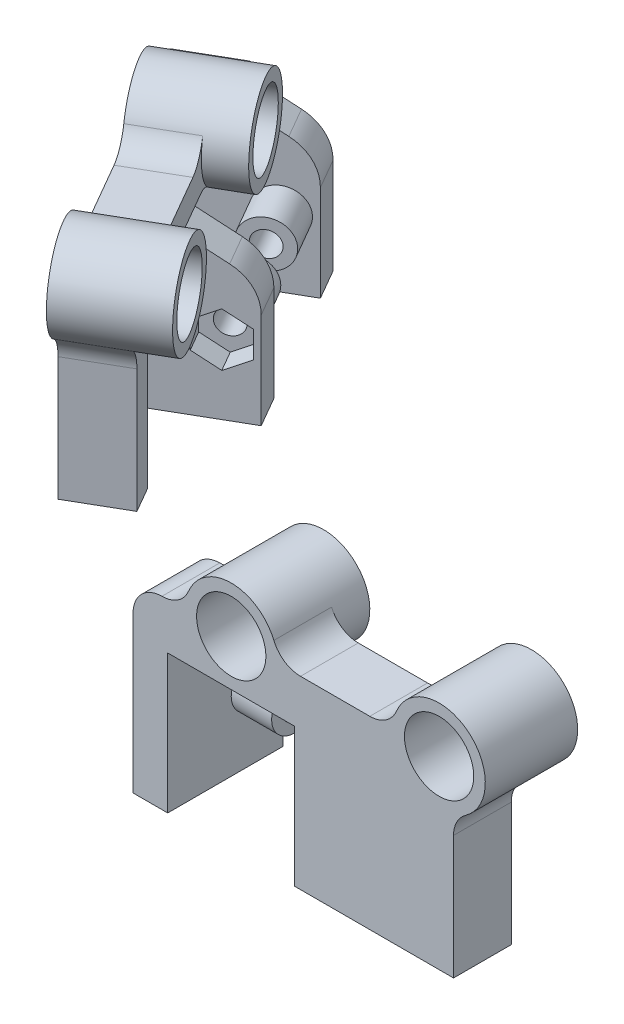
SolidWorks part; units mm, degrees
ref_plane "Plan de face" through (0, 0, 0) normal (0, 0, 1) x (1, 0, 0)
ref_plane "Plan de dessus" through (0, 0, 0) normal (0, 1, 0) x (1, 0, 0)
ref_plane "Plan de droite" through (0, 0, 0) normal (1, 0, 0) x (0, 0, -1)
sketch "Esquisse1" plane through (0, 0, 0) normal (0, 0, 1) x (1, 0, 0)
  line L0 (28, 0) -> (61, 0)
  line L1 (0, 0) -> (6, 0)
  line L2 (0, 0) -> (0, 32)
  line L3 (8, 40) -> (53, 40)
  line L4 (61, 0) -> (61, 32)
  line L6 (6, 0) -> (6, 24)
  line L7 (6, 24) -> (28, 24)
  line L8 (28, 0) -> (28, 24)
  arc A0 (53, 40) -> (61, 32) centre (53, 32) cw
  arc A1 (0, 32) -> (8, 40) centre (8, 32) cw
  dimension "D6" = 8
  dimension "D1" = 61
  dimension "D2" = 40
  dimension "D3" = 6
  dimension "D4" = 24
  dimension "D5" = 22
extrude "Boss.-Extru.1" add sketch "Esquisse1" along normal blind 5
sketch "Esquisse2" plane through (0, 0, 0) normal (0, 0, -1) x (-1, 0, 0)
  line L1 (-28, 0) -> (-61, 0) construction
  line L3 (0, 32) -> (0, 0) construction
  circle A0 centre (-53, 32) radius 8
  circle A1 centre (-17, 32) radius 8
  dimension "D1" = 16
  dimension "D4" = 16
  dimension "D2" = 17
  dimension "D3" = 32
  dimension "D5" = 32
  dimension "D6" = 36
extrude "Boss.-Extru.2" add sketch "Esquisse2" along normal blind 11
sketch "Esquisse3" plane through (0, 0, -11) normal (0, 0, -1) x (-1, 0, 0)
  circle A0 centre (-53, 32) radius 6
  circle A1 centre (-17, 32) radius 6
  dimension "D1" = 12
  dimension "D2" = 12
extrude "Enlèv. mat.-Extru.1" cut sketch "Esquisse3" against normal up to next
sketch "Esquisse4" plane through (0, 0, 0) normal (0, 0, -1) x (-1, 0, 0)
  line L0 (-45, 32) -> (-25, 32)
  line L1 (-46.755, 27) -> (-23.245, 27)
  line L2 (-55.5, 0) -> (-55.5, 24.4007)
  line L3 (-28, 0) -> (-61, 0) construction
  line L4 (-50.5, 0) -> (-50.5, 24.4007)
  line L5 (-10.755, 27) -> (0, 27)
  line L6 (0, 32) -> (0, 0) construction
  line L7 (-9, 32) -> (0, 32)
  line L8 (-50.5, 0) -> (-55.5, 0)
  line L9 (0, 32) -> (0, 27)
  arc A0 (-61, 32) -> (-53, 40) centre (-53, 32) ccw construction
  circle A1 centre (-53, 32) radius 8 construction
  arc A2 (-17, 40) -> (-17, 24) centre (-17, 32) ccw construction
  circle A3 centre (-17, 32) radius 8 construction
  arc A4 (-55.5, 24.4007) -> (-50.5, 24.4007) centre (-53, 32) ccw
  arc A5 (-46.755, 27) -> (-45, 32) centre (-53, 32) ccw
  arc A6 (-10.755, 27) -> (-9, 32) centre (-17, 32) ccw
  arc A7 (-25, 32) -> (-23.245, 27) centre (-17, 32) ccw
  dimension "D1" = 5
  dimension "D2" = 5
  dimension "D3" = 2.5
extrude "Boss.-Extru.3" add sketch "Esquisse4" along normal blind 5
sketch "Esquisse6" plane through (0, 0, 0) normal (0, 0, -1) x (-1, 0, 0)
  line L2 (-45, 32) -> (-25, 32)
  line L3 (-17, 40) -> (-53, 40)
  line L4 (-45, 32) -> (-25, 32)
  line L5 (-17, 40) -> (-53, 40)
  arc A2 (-45, 32) -> (-53, 40) centre (-53, 32) ccw
  arc A3 (-17, 40) -> (-25, 32) centre (-17, 32) ccw
  arc A4 (-45, 32) -> (-53, 40) centre (-53, 32) ccw
  arc A5 (-17, 40) -> (-25, 32) centre (-17, 32) ccw
  dimension "D1" = 0
extrude "Enlèv. mat.-Extru.4" cut sketch "Esquisse6" against normal up to next
sketch "Esquisse7" plane through (0, 0, 0) normal (0, 0, -1) x (-1, 0, 0)
  line L3 (-61, 0) -> (-55.5, 0)
  line L4 (-55.5, 0) -> (-55.5, 24.4007)
  line L5 (-61, 32) -> (-61, 0)
  line L6 (-61, 0) -> (-55.5, 0)
  line L7 (-55.5, 0) -> (-55.5, 24.4007)
  line L8 (-61, 32) -> (-61, 0)
  arc A1 (-61, 32) -> (-55.5, 24.4007) centre (-53, 32) ccw
  arc A2 (-61, 32) -> (-55.5, 24.4007) centre (-53, 32) ccw
  dimension "D1" = 0
extrude "Enlèv. mat.-Extru.5" cut sketch "Esquisse7" against normal up to next
sketch "Esquisse8" plane through (0, 0, 0) normal (0, 0, -1) x (-1, 0, 0)
  line L2 (-9, 32) -> (0, 32)
  line L3 (-8, 40) -> (-17, 40)
  line L4 (-9, 32) -> (0, 32)
  line L5 (-8, 40) -> (-17, 40)
  arc A2 (-9, 32) -> (-17, 40) centre (-17, 32) ccw
  arc A3 (0, 32) -> (-8, 40) centre (-8, 32) ccw
  arc A4 (-9, 32) -> (-17, 40) centre (-17, 32) ccw
  arc A5 (0, 32) -> (-8, 40) centre (-8, 32) ccw
  dimension "D1" = 0
extrude "Enlèv. mat.-Extru.6" cut sketch "Esquisse8" against normal up to next
sketch "Esquisse9" plane through (0, 0, 0) normal (-1, 0, 0) x (0, 0, 1)
  line L0 (0, 0) -> (-15, 0)
  line L1 (-5, 27) -> (-11, 23.5359)
  line L2 (-15, 16.6077) -> (-15, 0)
  line L3 (0, 27) -> (0, 0) construction
  line L5 (0, 0) -> (0, 24.4007) construction
  line L6 (-5, 27) -> (0, 27) construction
  line L8 (0, 0) -> (0, 27)
  line L9 (-5, 27) -> (0, 27)
  arc A0 (-11, 23.5359) -> (-15, 16.6077) centre (-7, 16.6077) ccw
  dimension "D3" = 8
  dimension "D1" = 15
  dimension "D2" = 120
extrude "Boss.-Extru.4" add sketch "Esquisse9" against normal blind 6
pattern_linear "Répétition linéaire1" count 2 spacing 28 along (1, 0, 0) of "Boss.-Extru.4"
sketch "Esquisse10" plane through (6, 0, 0) normal (1, 0, 0) x (0, 0, -1)
  line L0 (-5, 0) -> (15, 0) construction
  line L1 (-5, 0) -> (-5, 24) construction
  circle A0 centre (10, 12) radius 4
  dimension "D1" = 8
  dimension "D2" = 12
  dimension "D3" = 15
extrude "Boss.-Extru.5" add sketch "Esquisse10" along normal blind 7
pattern_linear "Répétition linéaire2" count 2 spacing 15 along (1, 0, 0) of "Boss.-Extru.5"
sketch "Esquisse11" plane through (0, 0, 0) normal (-1, 0, 0) x (0, 0, 1)
  circle A0 centre (-10, 12) radius 4
  dimension "D1" = 8
extrude "Enlèv. mat.-Extru.7" cut sketch "Esquisse11" against normal blind 4
sketch "Esquisse12" plane through (34, 0, 0) normal (1, 0, 0) x (0, 0, -1)
  line L1 (14, 9.6906) -> (14, 14.3094)
  line L2 (14, 14.3094) -> (10, 16.6188)
  line L3 (10, 16.6188) -> (6, 14.3094)
  line L4 (6, 14.3094) -> (6, 9.6906)
  line L5 (6, 9.6906) -> (10, 7.3812)
  line L6 (10, 7.3812) -> (14, 9.6906)
  circle A0 centre (10, 12) radius 4 construction
  dimension "D1" = 8
extrude "Enlèv. mat.-Extru.8" cut sketch "Esquisse12" against normal blind 4
sketch "Esquisse13" plane through (4, 0, 0) normal (-1, 0, 0) x (0, 0, 1)
  circle A0 centre (-10, 12) radius 2.15
  dimension "D1" = 4.3
extrude "Enlèv. mat.-Extru.9" cut sketch "Esquisse13" against normal up to surface (26 mm away)
fillet "Congé1" radius 5 9 edges at (10.755, 27, -2.5) (23.245, 27, -2.5) (50.5, 24.4007, -2.5) (55.5, 24.4007, 0) (0, 32, 0) (25, 32, 0) (45, 32, 0) (9, 32, 0) (46.755, 27, -2.5)
sketch "embase" plane through (0, 0, 0) normal (0, -1, 0) x (-1, 0, 0)
  line L0 (0, -5) -> (50.5534, 32.5579)
  line L1 (-55.5, 5) -> (60.9829, 90.6224)
  line L5 (50.5534, 32.5579) -> (78.3034, 80.6224)
  line L6 (78.3034, 80.6224) -> (60.9829, 90.6224)
  line L7 (0, -5) -> (0, 15) construction
  dimension "D1" = 62.9781
  dimension "D2" = 55.5
  dimension "D3" = 144.5664
  dimension "D4" = 20
  dimension "D5" = 53.39
ref_plane "esquisseAppui" through (-23.817, 0, 13.7508) normal (0.866, 0, -0.5) x (-0.5, 0, -0.866)
sketch "Esquisse15" plane through (-23.817, 0, 13.7508) normal (0.866, 0, -0.5) x (-0.5, 0, -0.866)
  line L0 (102.9727, 0) -> (108.9727, 0)
  line L1 (47.9727, 0) -> (80.9727, 0)
  line L2 (47.9727, 0) -> (47.9727, 32)
  line L3 (55.9727, 40) -> (100.9727, 40)
  line L4 (108.9727, 0) -> (108.9727, 32)
  line L6 (80.9727, 0) -> (80.9727, 24)
  line L7 (80.9727, 24) -> (102.9727, 24)
  line L8 (102.9727, 0) -> (102.9727, 24)
  arc A0 (100.9727, 40) -> (108.9727, 32) centre (100.9727, 32) cw
  arc A1 (47.9727, 32) -> (55.9727, 40) centre (55.9727, 32) cw
  point P13 (0, 0)
  dimension "D6" = 8
  dimension "D1" = 61
  dimension "D2" = 40
  dimension "D3" = 6
  dimension "D4" = 22
  dimension "D5" = 24
extrude "Boss.-Extru.6" add sketch "Esquisse15" along normal blind 5 separate body
sketch "Esquisse16" plane through (-19.4869, 0, 11.2508) normal (0.866, 0, -0.5) x (-0.5, 0, -0.866)
  line L0 (108.9727, 0) -> (108.9727, 32) construction
  line L1 (102.9727, 0) -> (108.9727, 0) construction
  line L2 (-23.4199, 0) -> (108.9727, 0) construction
  circle A0 centre (91.9727, 32) radius 8
  circle A1 centre (55.9727, 32) radius 8
  dimension "D3" = 16
  dimension "D4" = 16
  dimension "D1" = 36
  dimension "D2" = 17
  dimension "D5" = 32
  dimension "D6" = 32
extrude "Boss.-Extru.7" add sketch "Esquisse16" along normal blind 11
sketch "Esquisse17" plane through (-9.9606, 0, 5.7508) normal (0.866, 0, -0.5) x (-0.5, 0, -0.866)
  circle A0 centre (91.9727, 32) radius 6
  circle A1 centre (55.9727, 32) radius 6
  dimension "D1" = 12
  dimension "D2" = 12
extrude "Enlèv. mat.-Extru.10" cut sketch "Esquisse17" against normal up to next
sketch "Esquisse20" plane through (-19.4869, 0, 11.2508) normal (0.866, 0, -0.5) x (-0.5, 0, -0.866)
  line L1 (99.9727, 32) -> (108.9727, 32)
  line L8 (108.9727, 0) -> (108.9727, 32) construction
  line L10 (53.4727, 24.4007) -> (53.4727, 0)
  line L11 (-23.4199, 0) -> (108.9727, 0) construction
  line L12 (58.4727, 24.4007) -> (58.4727, 0)
  line L13 (53.4727, 0) -> (58.4727, 0)
  line L14 (63.9727, 32) -> (83.9727, 32)
  line L16 (62.2177, 27) -> (85.7277, 27)
  line L20 (98.2177, 27) -> (108.9727, 27)
  line L21 (108.9727, 32) -> (108.9727, 27)
  arc A0 (91.9727, 24) -> (91.9727, 40) centre (91.9727, 32) ccw construction
  arc A2 (98.2177, 27) -> (99.9727, 32) centre (91.9727, 32) ccw
  circle A9 centre (55.9727, 32) radius 8 construction
  arc A11 (47.9727, 32) -> (55.9727, 40) centre (55.9727, 32) ccw construction
  arc A12 (91.9727, 40) -> (91.9727, 24) centre (91.9727, 32) ccw construction
  circle A13 centre (91.9727, 32) radius 8 construction
  arc A14 (53.4727, 24.4007) -> (58.4727, 24.4007) centre (55.9727, 32) ccw
  arc A15 (62.2177, 27) -> (63.9727, 32) centre (55.9727, 32) ccw
  arc A18 (83.9727, 32) -> (85.7277, 27) centre (91.9727, 32) ccw
  dimension "D1" = 2.5
  dimension "D2" = 5
  dimension "D3" = 5
extrude "Boss.-Extru.10" add sketch "Esquisse20" along normal blind 5
sketch "Esquisse21" plane through (-19.4869, 0, 11.2508) normal (0.866, 0, -0.5) x (-0.5, 0, -0.866)
  line L2 (63.9727, 32) -> (83.9727, 32)
  line L3 (91.9727, 40) -> (55.9727, 40)
  line L4 (63.9727, 32) -> (83.9727, 32)
  line L5 (91.9727, 40) -> (55.9727, 40)
  arc A2 (91.9727, 40) -> (83.9727, 32) centre (91.9727, 32) ccw
  arc A3 (63.9727, 32) -> (55.9727, 40) centre (55.9727, 32) ccw
  arc A4 (91.9727, 40) -> (83.9727, 32) centre (91.9727, 32) ccw
  arc A5 (63.9727, 32) -> (55.9727, 40) centre (55.9727, 32) ccw
  dimension "D1" = 0
extrude "Enlèv. mat.-Extru.11" cut sketch "Esquisse21" against normal up to next
sketch "Esquisse22" plane through (-19.4869, 0, 11.2508) normal (0.866, 0, -0.5) x (-0.5, 0, -0.866)
  line L3 (53.4727, 0) -> (53.4727, 24.4007)
  line L4 (47.9727, 32) -> (47.9727, 0)
  line L5 (47.9727, 0) -> (53.4727, 0)
  line L6 (53.4727, 0) -> (53.4727, 24.4007)
  line L7 (47.9727, 32) -> (47.9727, 0)
  line L8 (47.9727, 0) -> (53.4727, 0)
  arc A1 (47.9727, 32) -> (53.4727, 24.4007) centre (55.9727, 32) ccw
  arc A2 (47.9727, 32) -> (53.4727, 24.4007) centre (55.9727, 32) ccw
  dimension "D1" = 0
extrude "Enlèv. mat.-Extru.12" cut sketch "Esquisse22" against normal up to next
sketch "Esquisse23" plane through (-19.4869, 0, 11.2508) normal (0.866, 0, -0.5) x (-0.5, 0, -0.866)
  line L2 (99.9727, 32) -> (108.9727, 32)
  line L3 (100.9727, 40) -> (91.9727, 40)
  line L4 (99.9727, 32) -> (108.9727, 32)
  line L5 (100.9727, 40) -> (91.9727, 40)
  arc A2 (108.9727, 32) -> (100.9727, 40) centre (100.9727, 32) ccw
  arc A3 (99.9727, 32) -> (91.9727, 40) centre (91.9727, 32) ccw
  arc A4 (108.9727, 32) -> (100.9727, 40) centre (100.9727, 32) ccw
  arc A5 (99.9727, 32) -> (91.9727, 40) centre (91.9727, 32) ccw
  dimension "D1" = 0
extrude "Enlèv. mat.-Extru.13" cut sketch "Esquisse23" against normal up to next
sketch "Esquisse24" plane through (-54.4863, 0, -94.3731) normal (-0.5, 0, -0.866) x (-0.866, 0, 0.5)
  line L0 (22.5015, 0) -> (7.5015, 0)
  line L1 (27.5015, 0) -> (7.5015, 0) construction
  line L2 (7.5015, 0) -> (7.5015, 16.6077)
  line L3 (11.5015, 23.5359) -> (17.5015, 27)
  line L4 (17.5015, 27) -> (22.5015, 27)
  line L5 (22.5015, 27) -> (22.5015, 0)
  arc A0 (7.5015, 16.6077) -> (11.5015, 23.5359) centre (15.5015, 16.6077) cw
  dimension "D2" = 8
  dimension "D1" = 120
  dimension "D3" = 15
extrude "Boss.-Extru.11" add sketch "Esquisse24" against normal blind 6
pattern_linear "Répétition linéaire3" count 2 spacing 28 along (0.5, 0, 0.866) of "Boss.-Extru.11"
sketch "Esquisse25" plane through (-51.4863, 0, -89.177) normal (0.5, 0, 0.866) x (0.866, 0, -0.5)
  line L0 (-7.5015, 0) -> (-27.5015, 0) construction
  line L2 (-27.5015, 24) -> (-27.5015, 0) construction
  circle A0 centre (-12.5015, 12) radius 4
  point P6 (-27.5015, 11.3577)
  dimension "D1" = 8
  dimension "D2" = 12
  dimension "D3" = 15
extrude "Boss.-Extru.12" add sketch "Esquisse25" along normal blind 7
pattern_linear "Répétition linéaire4" count 2 spacing 15 along (0.5, 0, 0.866) of "Boss.-Extru.12"
sketch "Esquisse26" plane through (-54.4863, 0, -94.3731) normal (-0.5, 0, -0.866) x (-0.866, 0, 0.5)
  circle A0 centre (12.5015, 12) radius 4
  dimension "D1" = 8
extrude "Enlèv. mat.-Extru.14" cut sketch "Esquisse26" against normal blind 4
sketch "Esquisse27" plane through (-37.4863, 0, -64.9283) normal (0.5, 0, 0.866) x (0.866, 0, -0.5)
  line L1 (-8.5015, 9.6906) -> (-8.5015, 14.3094)
  line L2 (-8.5015, 14.3094) -> (-12.5015, 16.6188)
  line L3 (-12.5015, 16.6188) -> (-16.5015, 14.3094)
  line L4 (-16.5015, 14.3094) -> (-16.5015, 9.6906)
  line L5 (-16.5015, 9.6906) -> (-12.5015, 7.3812)
  line L6 (-12.5015, 7.3812) -> (-8.5015, 9.6906)
  circle A0 centre (-12.5015, 12) radius 4 construction
  dimension "D1" = 8
extrude "Enlèv. mat.-Extru.15" cut sketch "Esquisse27" against normal blind 4
sketch "Esquisse28" plane through (-52.4863, 0, -90.909) normal (-0.5, 0, -0.866) x (-0.866, 0, 0.5)
  circle A0 centre (12.5015, 12) radius 2.15
  dimension "D1" = 4.3
extrude "Enlèv. mat.-Extru.16" cut sketch "Esquisse28" against normal up to surface (26 mm away)
fillet "Congé2" radius 5 9 edges at (-66.4307, 27, -75.0582) (-60.1857, 27, -64.2416) (-48.4307, 27, -43.8813) (-46.5582, 24.4007, -40.6381) (-46.2232, 24.4007, -35.0579) (-51.4732, 32, -44.1512) (-61.4732, 32, -61.4717) (-69.4732, 32, -75.3281) (-73.9732, 32, -83.1224)
